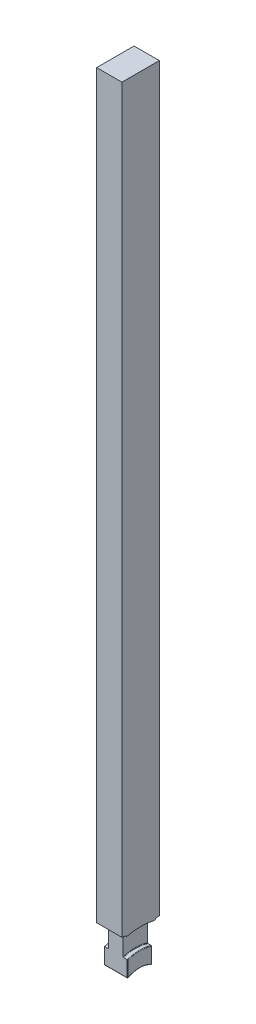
SolidWorks part; units mm, degrees
other "<4-48 DETENT>-<Imported2>"
other "<4-48 DETENT>-<Imported1>"
ref_plane "Front Plane" through (0, 0, 0) normal (0, 0, 1) x (1, 0, 0)
ref_plane "Top Plane" through (0, 0, 0) normal (0, 1, 0) x (1, 0, 0)
ref_plane "Right Plane" through (0, 0, 0) normal (1, 0, 0) x (0, 0, -1)
sketch "Sketch1" plane through (0, 0, 0) normal (1, 0, 0) x (0, 0, -1)
  line L0 (-4.8895, 209.55) -> (-4.8895, 0)
  line L1 (0, 249.2329) -> (0, 0) construction
  line L2 (4.8895, 209.55) -> (4.8895, 0)
  line L3 (-4.8895, 209.55) -> (4.8895, 209.55)
  line L4 (-4.8895, 0) -> (4.8895, 0)
  circle A1 centre (0, 0) radius 6.35 construction
  point P5 (0, 5.969)
  dimension "D1" = 6.35
  dimension "D2" = 203.2
  dimension "D3" = 9.779
  dimension "D4" = 0.381
extrude "Boss-Extrude1" add sketch "Sketch1" along normal mid plane 6.604
sketch "Sketch2" plane through (0, 0, 0) normal (0, 0, 1) x (1, 0, 0)
  line L0 (3.302, 10.3124) -> (1.905, 10.3124)
  line L1 (3.302, 209.55) -> (3.302, 0) construction
  line L2 (1.905, 10.3124) -> (1.905, 15.875)
  line L3 (1.905, 15.875) -> (3.302, 15.875)
  line L4 (3.302, 15.875) -> (3.302, 10.3124)
  line L5 (0, 29.9173) -> (0, 0) construction
  line L6 (-3.302, 15.875) -> (-3.302, 10.3124)
  line L7 (-1.905, 15.875) -> (-3.302, 15.875)
  line L8 (-1.905, 10.3124) -> (-1.905, 15.875)
  line L9 (-3.302, 10.3124) -> (-1.905, 10.3124)
  line L10 (-8.8482, 0) -> (24.5305, 0) construction
  dimension "D1" = 3.81
  dimension "D2" = 15.875
  dimension "D3" = 10.3124
revolve "Cut-Revolve1" cut sketch "Sketch2" angle 360 about L10
sketch "Sketch6" plane through (0, 0, 0) normal (1, 0, 0) x (0, 0, -1)
  line L0 (0, 19.903) -> (0, 3.2785) construction
  line L1 (3.175, 0) -> (18.415, 0)
  line L2 (3.175, 0) -> (3.175, 14.351)
  line L3 (4.699, 15.875) -> (18.415, 15.875)
  line L4 (18.415, 0) -> (18.415, 15.875)
  line L9 (-3.175, 0) -> (-18.415, 0)
  line L10 (-18.415, 0) -> (-18.415, 15.875)
  line L11 (-4.699, 15.875) -> (-18.415, 15.875)
  line L12 (-3.175, 0) -> (-3.175, 14.351)
  line L13 (-4.8895, 0) -> (4.8895, 0) construction
  line L14 (-4.8895, 22.1375) -> (-4.8895, 15.875) construction
  line L15 (-4.8895, 209.55) -> (-4.8895, 15.1033) construction
  arc A0 (3.175, 14.351) -> (4.699, 15.875) centre (4.699, 14.351) cw
  arc A1 (-3.175, 14.351) -> (-4.699, 15.875) centre (-4.699, 14.351) ccw
  dimension "D3" = 1.524
  dimension "D1" = 6.35
  dimension "D2" = 15.24
  dimension "D4" = 15.875
extrude "Cut-Extrude2" cut sketch "Sketch6" against normal through all both and the other way through all
sketch "Sketch7" plane through (0, 0, 0) normal (1, 0, 0) x (0, 0, -1)
  circle A0 centre (0, 0) radius 6.35
  dimension "D1" = 6.35
extrude "Cut-Extrude3" cut sketch "Sketch7" against normal through all both and the other way through all
sketch "Sketch8" plane through (0, 0, 0) normal (0, 0, 1) x (1, 0, 0)
  line L1 (-3.302, 10.3124) -> (-3.048, 10.3124)
  line L2 (-3.302, 10.3124) -> (-3.302, 5.4993)
  line L3 (-3.302, 5.4993) -> (-3.048, 5.4993)
  line L4 (-3.048, 10.3124) -> (-3.048, 5.4993)
  line L5 (0, 18.3159) -> (0, 0) construction
  line L6 (3.048, 10.3124) -> (3.048, 5.4993)
  line L7 (3.302, 5.4993) -> (3.048, 5.4993)
  line L8 (3.302, 10.3124) -> (3.302, 5.4993)
  line L9 (3.302, 10.3124) -> (3.048, 10.3124)
  line L10 (-3.302, 5.4993) -> (3.302, 5.4993) construction
  dimension "D1" = 6.096
extrude "Cut-Extrude4" cut sketch "Sketch8" against normal through all both and the other way through all
fillet "Fillet1" radius 0.762 2 edges at (-1.905, 15.875, 0) (1.905, 15.875, 0)
fillet "Fillet2" radius 0.127 2 edges at (-1.905, 10.3124, 0) (1.905, 10.3124, 0)
hole_wizard "#4-48 Tapped Hole1" positions "Sketch3" profile "Sketch4" tap size "#4-48" standard "ANSI Inch"
sketch "Sketch3" plane through (0, 0, 0) normal (0, 1, 0) x (1, 0, 0)
  point P0 (0, 0)
sketch "Sketch4" plane through (0, 0, 0) normal (1, 0, 0) x (0, 0, -1)
  line L0 (0, 0) -> (0, 13.9215)
  line L1 (0, 13.9215) -> (1.1874, 13.208)
  line L2 (1.1874, 13.208) -> (1.1874, 0)
  line L5 (1.1874, 0) -> (0, 0)
  line L10 (0, 13.9215) -> (-1.1875, 13.208) construction
  line L11 (0, -6.35) -> (0, 107.95) construction
  dimension "Tap Drill Dia." = 2.3749
  dimension "Tap Drill Depth" = 13.208
  dimension "Drill Angle" = 118
fillet "Fillet3" radius 0.127 10 edges at (0, 5.4993, -3.175) (-3.048, 6.35, 0) (3.048, 6.35, 0) (0, 5.4993, 3.175) (-3.048, 7.6554, 3.175) (-3.048, 10.3124, 0) (-3.048, 7.6554, -3.175) (3.048, 7.6554, -3.175) (3.048, 10.3124, 0) (3.048, 7.6554, 3.175)
ref_plane "Plane1" through (0, 5.969, 0) normal (0, 1, 0) x (1, 0, 0)
inserted part "4-48 DETENT"
move or copy body "Body-Move/Copy2" placed by mates yes
